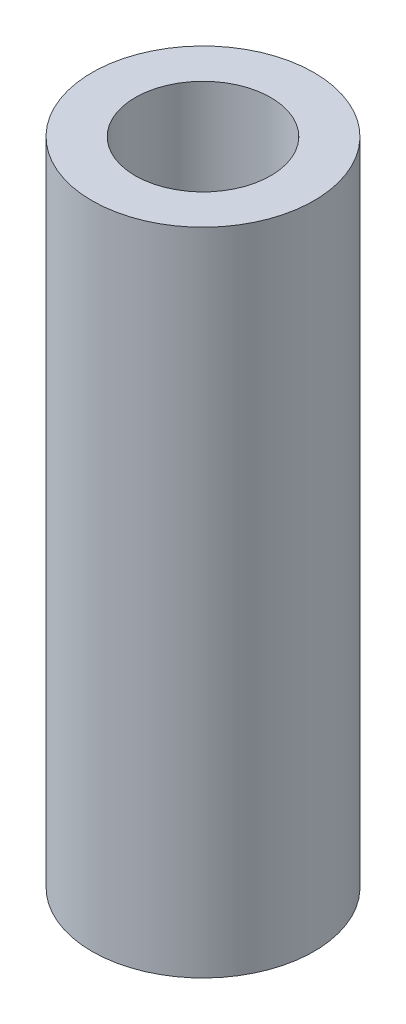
SolidWorks part; units mm, degrees
ref_plane "Front Plane" through (0, 0, 0) normal (0, 0, 1) x (1, 0, 0)
ref_plane "Top Plane" through (0, 0, 0) normal (0, 1, 0) x (1, 0, 0)
ref_plane "Right Plane" through (0, 0, 0) normal (1, 0, 0) x (0, 0, -1)
sketch "Sketch1" plane through (0, 0, 0) normal (0, 1, 0) x (1, 0, 0)
  circle A0 centre (0, 0) radius 4.0767
  circle A1 centre (0, 0) radius 2.4892
  dimension "D1" = 4.9784
  dimension "D2" = 1.5875
extrude "Boss-Extrude1" add sketch "Sketch1" along normal mid plane 23.876
